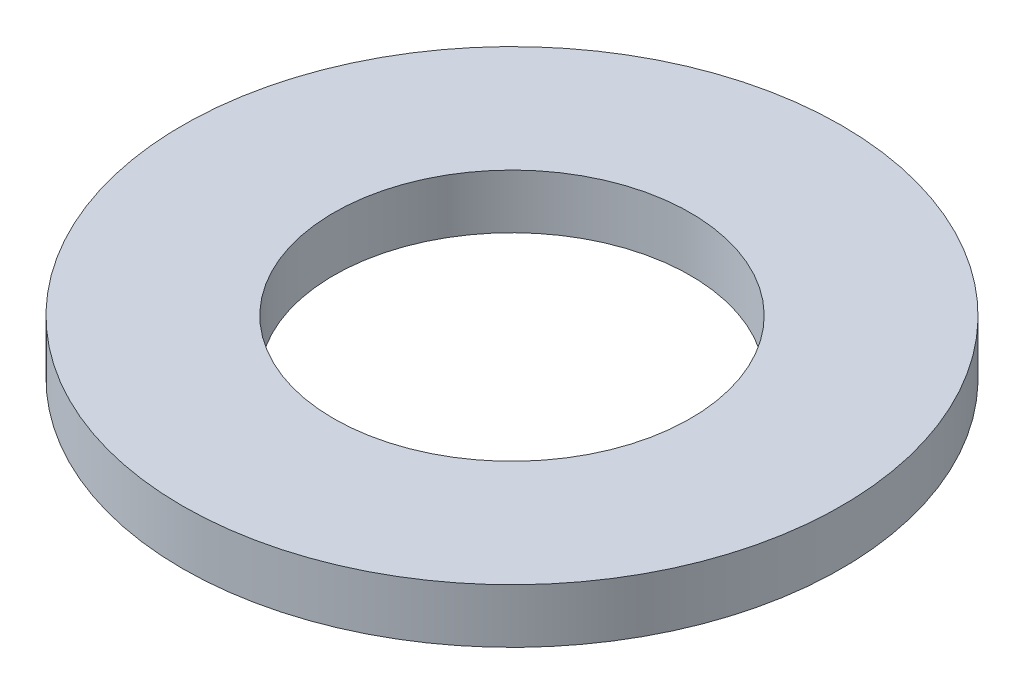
SolidWorks part; units mm, degrees
ref_plane "Front" through (0, 0, 0) normal (0, 0, 1) x (1, 0, 0)
ref_plane "Top" through (0, 0, 0) normal (0, 1, 0) x (1, 0, 0)
ref_plane "Right" through (0, 0, 0) normal (1, 0, 0) x (0, 0, -1)
sketch "Sketch1" plane through (0, 0, 0) normal (0, 1, 0) x (1, 0, 0)
  circle A0 centre (0, 0) radius 23
  circle A1 centre (0, 0) radius 42.5
extrude "Extrude1" add sketch "Sketch1" along normal blind 7
